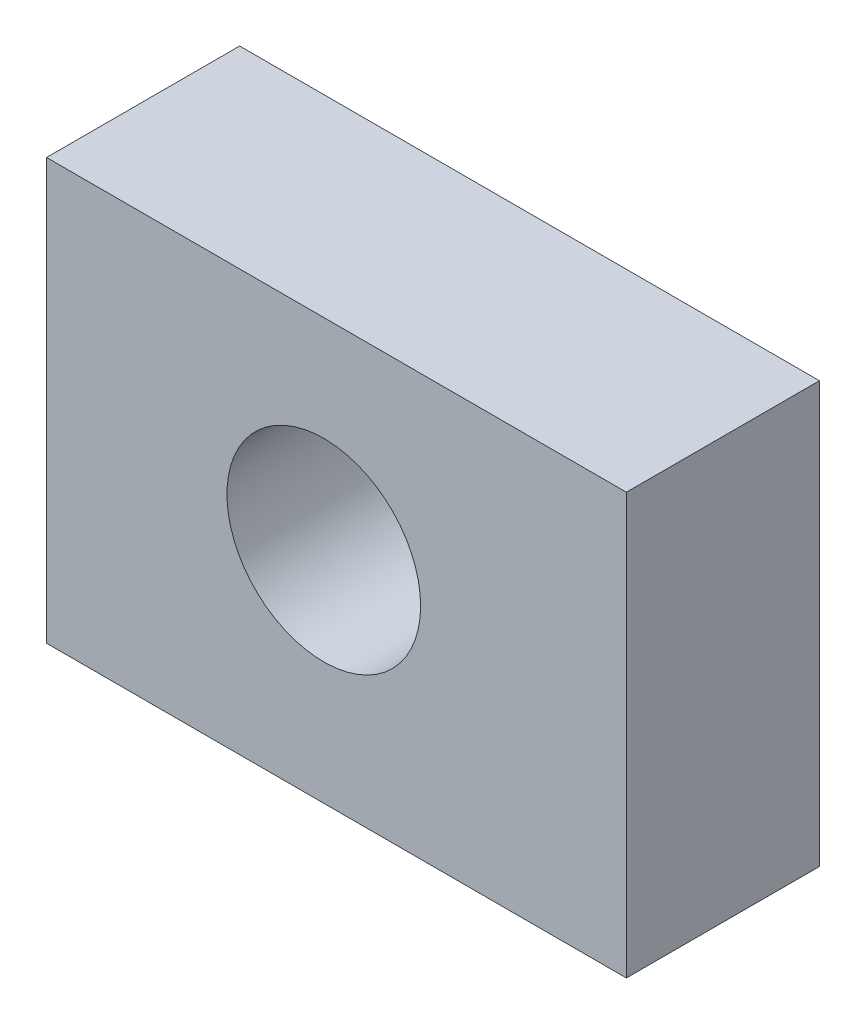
SolidWorks part; units mm, degrees
ref_plane "Front Plane" through (0, 0, 0) normal (0, 0, 1) x (1, 0, 0)
ref_plane "Top Plane" through (0, 0, 0) normal (0, 1, 0) x (1, 0, 0)
ref_plane "Right Plane" through (0, 0, 0) normal (1, 0, 0) x (0, 0, -1)
sketch "Sketch1" plane through (0, 0, 0) normal (0, 0, 1) x (1, 0, 0)
  line L1 (0, 0) -> (49.581, 0)
  line L2 (0, 0) -> (0, 35.978)
  line L3 (0, 35.978) -> (49.581, 35.978)
  line L4 (49.581, 0) -> (49.581, 35.978)
extrude "Extrude1" add sketch "Sketch1" along normal blind 16.51
sketch "Sketch2" plane through (0, 0, 16.51) normal (0, 0, 1) x (1, 0, 0)
  circle A0 centre (23.7057, 18.7511) radius 8.2802
extrude "Cut-Extrude1" cut sketch "Sketch2" against normal through all
